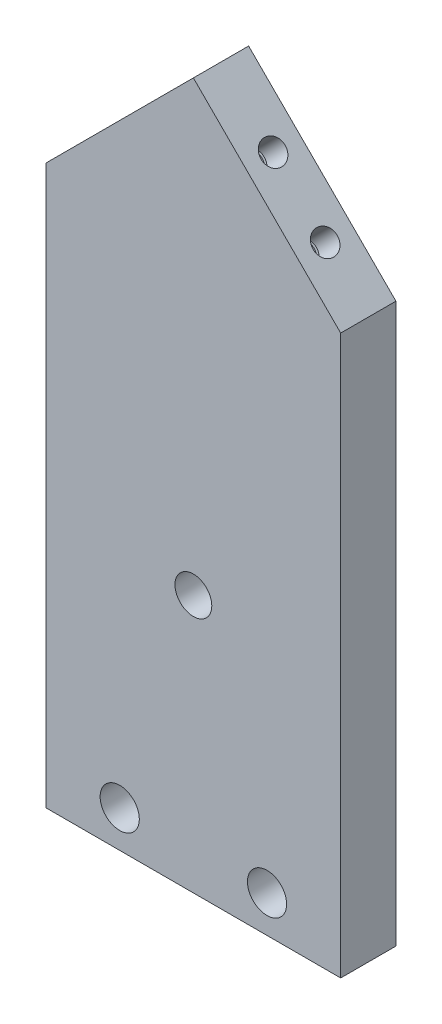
SolidWorks part; units mm, degrees
ref_plane "Front Plane" through (0, 0, 0) normal (0, 0, 1) x (1, 0, 0)
ref_plane "Top Plane" through (0, 0, 0) normal (0, 1, 0) x (1, 0, 0)
ref_plane "Right Plane" through (0, 0, 0) normal (1, 0, 0) x (0, 0, -1)
sketch "Sketch1" plane through (0, 0, 0) normal (0, 0, 1) x (1, 0, 0)
  line L0 (25.4, 121.1169) -> (50.8, 95.7169)
  line L1 (25.4, -0.584) -> (25.4, 5.766) construction
  line L2 (50.8, 95.7169) -> (50.8, -0.584)
  line L3 (25.4, 121.1169) -> (0, 95.7169)
  line L5 (25.4, -85.429) -> (25.4, -0.584) construction
  line L8 (25.4, 121.1169) -> (25.4, -0.584) construction
  line L10 (0, 95.7169) -> (0, -0.584)
  line L11 (25.4, -85.429) -> (-130.3147, 70.2857) construction
  line L12 (12.7, 5.766) -> (38.1, 5.766) construction
  line L15 (0, -0.584) -> (50.8, -0.584)
  dimension "D1" = 84.8449
  dimension "D3" = 6.35
  dimension "D4" = 25.4
  dimension "D5" = 121.701
  dimension "D6" = 146.05
extrude "Boss-Extrude2" add sketch "Sketch1" along normal blind 9.525
hole_wizard "1/4 Clearance Hole1" positions "Sketch3" profile "Sketch4" hole size "1/4" standard "ANSI Inch"
sketch "Sketch3" plane through (0, 0, 9.525) normal (0, 0, 1) x (1, 0, 0)
  point P0 (12.7, 5.766)
  point P3 (38.1, 5.766)
sketch "Sketch4" plane through (12.7, 5.766, 9.525) normal (1, 0, 0) x (0, -1, 0)
  line L0 (0, 0) -> (0, 9.525)
  line L1 (0, 9.525) -> (3.3782, 9.525)
  line L2 (3.3782, 9.525) -> (3.3782, 0)
  line L5 (3.3782, 0) -> (0, 0)
  line L11 (0, -6.35) -> (0, 107.95) construction
  dimension "Thru Hole Dia." = 6.7564
  dimension "Thru Hole Depth" = 9.525
ref_plane "Plane4" through (25.4, 0, 0) normal (1, 0, 0) x (0, 0, -1)
sketch "Sketch5" plane through (-47.8585, 47.8585, 0) normal (-0.7071, 0.7071, 0) x (0, 0, 1)
  line L0 (4.7625, 103.6031) -> (4.7625, 90.9031) construction
  line L1 (9.525, 103.6031) -> (0, 103.6031) construction
  line L2 (4.7625, 90.9031) -> (4.7625, 78.2031) construction
  dimension "D1" = 12.7
  dimension "D2" = 12.7
hole_wizard "#8-32 Tapped Hole1" positions "Sketch7" profile "Sketch6" tap size "#8-32" standard "ANSI Inch"
sketch "Sketch7" plane through (-47.8585, 47.8585, 0) normal (-0.7071, 0.7071, 0) x (0.7071, 0.7071, 0)
  point P0 (90.9031, -4.7625)
  point P3 (78.2031, -4.7625)
sketch "Sketch6" plane through (16.4197, 112.1367, 4.7625) normal (0, 0, 1) x (-0.7071, -0.7071, 0)
  line L0 (0, 0) -> (0, 8.4038)
  line L1 (0, 8.4038) -> (1.7272, 7.366)
  line L2 (1.7272, 7.366) -> (1.7272, 5.08)
  line L3 (1.7272, 5.08) -> (2.0828, 5.08)
  line L4 (2.0828, 5.08) -> (2.0828, 0)
  line L5 (2.0828, 0) -> (0, 0)
  line L10 (0, 8.4038) -> (-1.7272, 7.366) construction
  line L11 (0, -6.35) -> (0, 107.95) construction
  dimension "Tap Drill Dia." = 3.4544
  dimension "Tap Drill Depth" = 7.366
  dimension "Thread Major Dia." = 4.1656
  dimension "Thread Depth" = 5.08
  dimension "Drill Angle" = 118
mirror "Mirror1" about plane through (25.4, 0, 0) normal (1, 0, 0) of "#8-32 Tapped Hole1"
sketch "Sketch8" plane through (0, 0, 9.525) normal (0, 0, 1) x (1, 0, 0)
  line L0 (25.4, -0.584) -> (25.4, 43.866) construction
  line L1 (0, -0.584) -> (50.8, -0.584) construction
  dimension "D1" = 44.45
hole_wizard "1/4-20 Tapped Hole1" positions "Sketch10" profile "Sketch9" tap size "1/4-20" standard "ANSI Inch"
sketch "Sketch10" plane through (0, 0, 9.525) normal (0, 0, 1) x (1, 0, 0)
  point P0 (25.4, 43.866)
sketch "Sketch9" plane through (25.4, 43.866, 9.525) normal (1, 0, 0) x (0, -1, 0)
  line L0 (0, 0) -> (0, 9.525)
  line L1 (0, 9.525) -> (3.175, 9.525)
  line L2 (3.175, 9.525) -> (3.175, 0)
  line L5 (3.175, 0) -> (0, 0)
  line L11 (0, -6.35) -> (0, 107.95) construction
  dimension "Thread Major Dia." = 6.35
  dimension "Thru Tap Drill Depth" = 9.525
